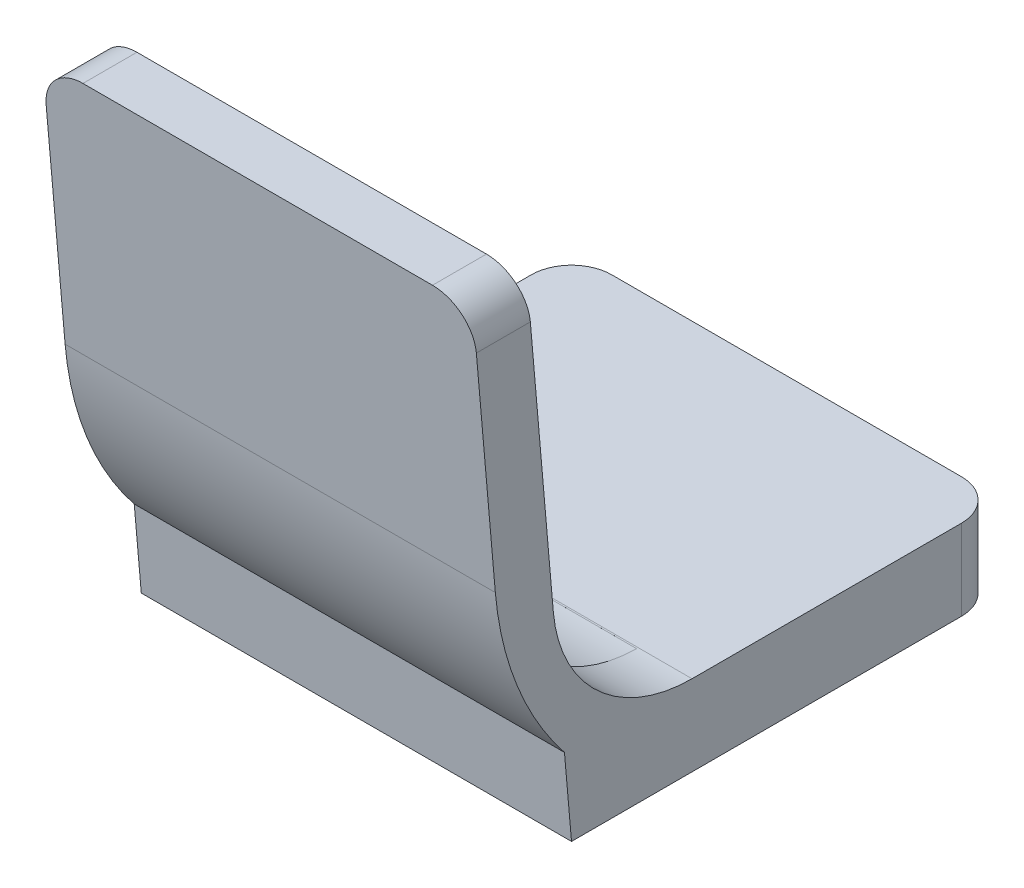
SolidWorks part; units mm, degrees
ref_plane "Face" through (0, 0, 0) normal (0, 0, 1) x (1, 0, 0)
ref_plane "Dessus" through (0, 0, 0) normal (0, 1, 0) x (1, 0, 0)
ref_plane "Droite" through (0, 0, 0) normal (1, 0, 0) x (0, 0, -1)
sketch "Esquisse1" plane through (0, 0, 0) normal (1, 0, 0) x (0, 0, -1)
  line L0 (16, 0) -> (4.4825, 0)
  line L1 (16, 0) -> (16, -3)
  line L2 (16, -3) -> (0, -3)
  line L4 (0, -3) -> (-0.2625, 0)
  line L5 (-2.833, 6.4337) -> (-3.6699, 16)
  line L6 (-1.6623, 16) -> (-3.6699, 16)
  line L7 (-0.676, 4.727) -> (-1.6623, 16)
  arc A0 (-0.676, 4.727) -> (4.4825, 0) centre (4.4825, 5.1783) ccw
  arc A1 (-2.833, 6.4337) -> (-0.2625, 0) centre (9.1214, 7.4796) ccw
  dimension "D1" = 2
  dimension "D2" = 3
  dimension "D3" = 19
extrude "Extrusion1" add sketch "Esquisse1" along normal mid plane 16
sketch "Esquisse2" plane through (0, -3, 0) normal (0, -1, 0) x (1, 0, 0)
  line L0 (8, -16) -> (-8, -16) construction
  line L1 (7, -1) -> (-7, -1)
  line L2 (7, -1) -> (7, -15)
  line L3 (7, -15) -> (-7, -15)
  line L4 (-7, -1) -> (-7, -15)
  line L5 (8, 0) -> (8, -16) construction
  line L6 (8, 0) -> (-8, 0) construction
  line L7 (-8, 0) -> (-8, -16) construction
  circle A1 centre (0, -8) radius 3
  dimension "D8" = 6
  dimension "D1" = 1
  dimension "D2" = 1
  dimension "D3" = 1
  dimension "D4" = 1
  dimension "D6" = 8
  dimension "D7" = 8
extrude "Enlèv. mat.-Extru.3" cut sketch "Esquisse2" against normal blind 2
sketch "Esquisse3" plane through (0, -3, 0) normal (0, -1, 0) x (1, 0, 0)
  circle A0 centre (0, -8) radius 2.5
  circle A1 centre (0, -8) radius 3 construction
  dimension "D1" = 5
extrude "Enlèv. mat.-Extru.4" cut sketch "Esquisse3" against normal blind 2
sketch "Esquisse4" plane through (0, 0, 0) normal (1, 0, 0) x (0, 0, -1)
  line L1 (-1.6623, 16) -> (-1.6623, 6.0827)
  line L3 (4.4204, 0) -> (-1.6623, 16)
  arc A0 (-1.6623, 6.0827) -> (4.4204, 0) centre (4.4204, 6.0827) ccw
extrude "Enlèv. mat.-Extru.5" cut sketch "Esquisse4" against normal mid plane 12
fillet "Congé1" radius 1.5 4 edges at (8, 16, 2.6661) (-8, 16, 2.6661) (8, -1.5, -16) (-8, -1.5, -16)
